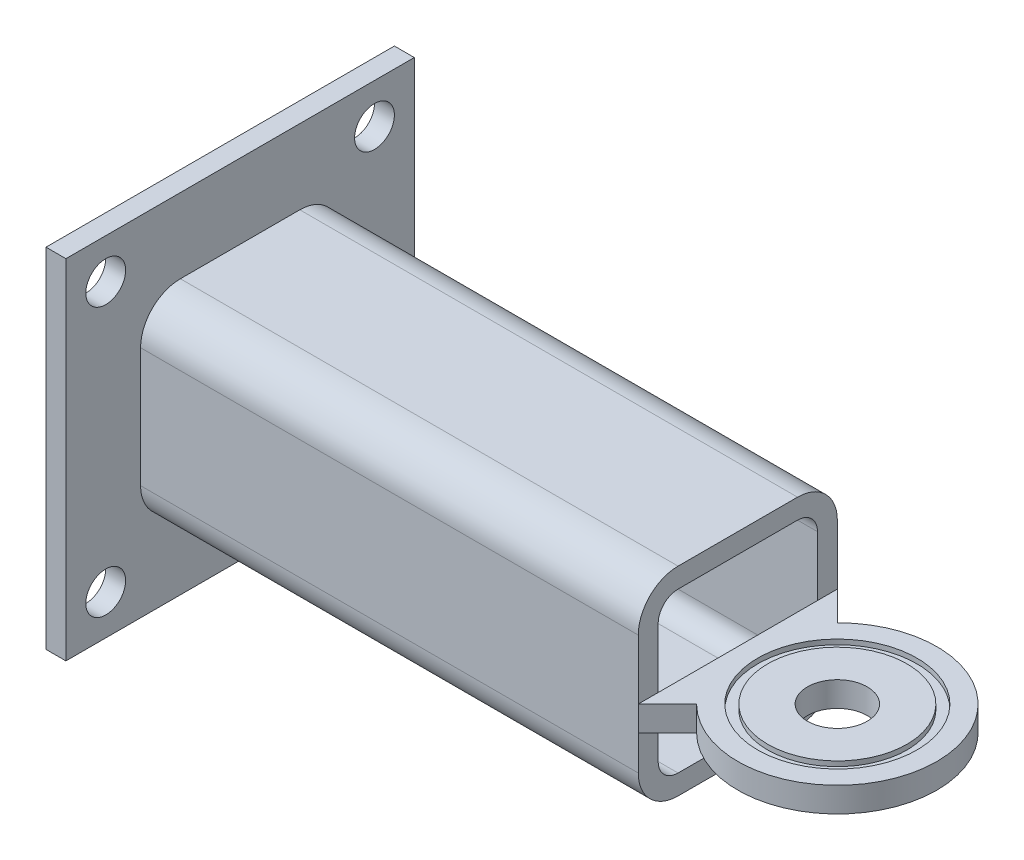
SolidWorks part; units mm, degrees
ref_plane "Front Plane" through (0, 0, 0) normal (0, 0, 1) x (1, 0, 0)
ref_plane "Top Plane" through (0, 0, 0) normal (0, 1, 0) x (1, 0, 0)
ref_plane "Right Plane" through (0, 0, 0) normal (1, 0, 0) x (0, 0, -1)
sketch "Sketch1" plane through (0, 0, 0) normal (0, 1, 0) x (1, 0, 0)
  line L0 (-27.3244, 0) -> (22.6756, 0)
  dimension "D1" = 50
other "Square tube 20 X 20 X 2(1)"
ref_plane "Plane1" through (-27.3244, 0, 0) normal (1, 0, 0) x (0, 0, -1)
sketch "Sketch11" plane through (-27.3244, 0, 0) normal (1, 0, 0) x (0, 0, -1)
  line L0 (-6, -8) -> (6, -8)
  line L1 (-8, -6) -> (-8, 6)
  line L2 (6, 8) -> (-6, 8)
  line L3 (8, 6) -> (8, -6)
  line L4 (-6, -10) -> (6, -10)
  line L5 (-10, -6) -> (-10, 6)
  line L6 (6, 10) -> (-6, 10)
  line L7 (10, 6) -> (10, -6)
  arc A0 (10, 6) -> (6, 10) centre (6, 6) ccw
  arc A1 (6, -10) -> (10, -6) centre (6, -6) ccw
  arc A2 (-10, -6) -> (-6, -10) centre (-6, -6) ccw
  arc A3 (-6, 10) -> (-10, 6) centre (-6, 6) ccw
  arc A4 (-6, 8) -> (-8, 6) centre (-6, 6) ccw
  arc A5 (8, 6) -> (6, 8) centre (6, 6) ccw
  arc A6 (6, -8) -> (8, -6) centre (6, -6) ccw
  arc A7 (-8, -6) -> (-6, -8) centre (-6, -6) ccw
  point P0 (-10, 0)
  point P1 (10, 0)
  point P2 (0, 10)
  point P3 (0, -10)
  point P4 (0, 0)
  point P5 (-10, -10)
  point P6 (10, -10)
  point P7 (10, 10)
  point P8 (-10, 10)
  point P33 (0, 0)
  dimension "D1" = 4
  dimension "Thickness" = 2
  dimension "V_leg" = 20
sketch "Sketch12" plane through (22.6756, 0, 0) normal (1, 0, 0) x (0, 0, -1)
  line L0 (10, -6) -> (10, 6) construction
  line L2 (-10, 0) -> (-10, -2.5)
  line L3 (-10, -2.5) -> (10, -2.5)
  line L4 (10, 0) -> (10, -2.5)
  line L5 (0, 0) -> (10, -2.5) construction
  line L6 (-10, -2.5) -> (0, 0) construction
  line L7 (-10, 0) -> (10, 0)
  point P0 (0, 0)
  dimension "D1" = 20
  dimension "D2" = 2.5
extrude "Boss-Extrude1" add sketch "Sketch12" along normal blind 20
sketch "Sketch15" plane through (0, 0, 0) normal (0, 1, 0) x (1, 0, 0)
  line L0 (42.6756, -10) -> (22.6756, -10) construction
  line L1 (32.6756, 10) -> (42.6756, 10)
  line L4 (42.6756, 10) -> (42.6756, 0)
  line L5 (42.6756, 0) -> (42.6756, -10)
  line L6 (39.7467, 7.0711) -> (42.6756, 10) construction
  line L7 (42.6756, -10) -> (32.6756, -10)
  arc A0 (32.6756, 10) -> (42.6756, 0) centre (32.6756, 0) cw
  arc A1 (42.6756, 0) -> (32.6756, -10) centre (32.6756, 0) cw
  point P0 (32.6756, 0)
extrude "Cut-Extrude1" cut sketch "Sketch15" against normal blind 20 contours L4 L1 A0 | A1 L7 L5
sketch "Sketch16" plane through (0, 0, 0) normal (0, 1, 0) x (1, 0, 0)
  line L0 (25.6046, 7.0711) -> (22.6756, 10)
  line L1 (22.6756, 10) -> (32.6756, 10)
  line L2 (25.6046, -7.0711) -> (22.6756, -10)
  line L3 (22.6756, -10) -> (32.6756, -10)
  arc A0 (32.6756, 10) -> (25.6046, 7.0711) centre (32.6756, 0) ccw
  arc A1 (25.6046, -7.0711) -> (32.6756, -10) centre (32.6756, 0) ccw
extrude "Cut-Extrude2" cut sketch "Sketch16" against normal blind 20
sketch "Sketch17" plane through (0, 0, 0) normal (0, 1, 0) x (1, 0, 0)
  circle A0 centre (32.6756, 0) radius 3
  dimension "D1" = 6
extrude "Cut-Extrude3" cut sketch "Sketch17" against normal blind 20
sketch "Sketch18" plane through (0, 0, 0) normal (0, 1, 0) x (1, 0, 0)
  circle A0 centre (32.6756, 0) radius 8
  circle A1 centre (32.6756, 0) radius 7
  dimension "D1" = 16
  dimension "D2" = 14
extrude "Cut-Extrude4" cut sketch "Sketch18" against normal blind 0.5
sketch "Sketch19" plane through (0, -2.5, 0) normal (0, -1, 0) x (1, 0, 0)
  circle A1 centre (32.6756, 0) radius 7
  circle A2 centre (32.6756, 0) radius 7
  circle A3 centre (32.6756, 0) radius 8
  circle A4 centre (32.6756, 0) radius 8
  dimension "D1" = 0
  dimension "D2" = 0
extrude "Cut-Extrude5" cut sketch "Sketch19" against normal blind 0.2
sketch "Sketch20" plane through (-27.3244, 0, 0) normal (-1, 0, 0) x (0, 0, 1)
  line L1 (-17.5, 17.5) -> (17.5, 17.5)
  line L2 (-17.5, 17.5) -> (-17.5, -17.5)
  line L3 (-17.5, -17.5) -> (17.5, -17.5)
  line L4 (17.5, 17.5) -> (17.5, -17.5)
  line L5 (-17.5, 17.5) -> (17.5, -17.5) construction
  line L6 (-17.5, -17.5) -> (17.5, 17.5) construction
  point P0 (0, 0)
  dimension "D1" = 35
  dimension "D2" = 35
extrude "Boss-Extrude2" add sketch "Sketch20" along normal blind 2
sketch "Sketch21" plane through (-27.3244, 0, 0) normal (1, 0, 0) x (0, 0, -1)
  line L0 (-17.5, 17.5) -> (17.5, 17.5) construction
  line L1 (-13.5, -13.5) -> (13.5, -13.5)
  line L2 (-13.5, -13.5) -> (-13.5, 13.5)
  line L3 (-13.5, 13.5) -> (13.5, 13.5)
  line L4 (13.5, -13.5) -> (13.5, 13.5)
  line L5 (-13.5, -13.5) -> (13.5, 13.5) construction
  line L6 (-13.5, 13.5) -> (13.5, -13.5) construction
  line L7 (-17.5, -17.5) -> (-17.5, 17.5) construction
  circle A0 centre (13.5, 13.5) radius 2
  circle A1 centre (13.5, -13.5) radius 2
  circle A2 centre (-13.5, -13.5) radius 2
  circle A3 centre (-13.5, 13.5) radius 2
  point P0 (0, 0)
  dimension "D3" = 4
  dimension "D4" = 4
  dimension "D5" = 4
  dimension "D6" = 4
  dimension "D1" = 4
  dimension "D2" = 4
extrude "Cut-Extrude6" cut sketch "Sketch21" against normal blind 2 contours A3 | A2 | A1 | A0
